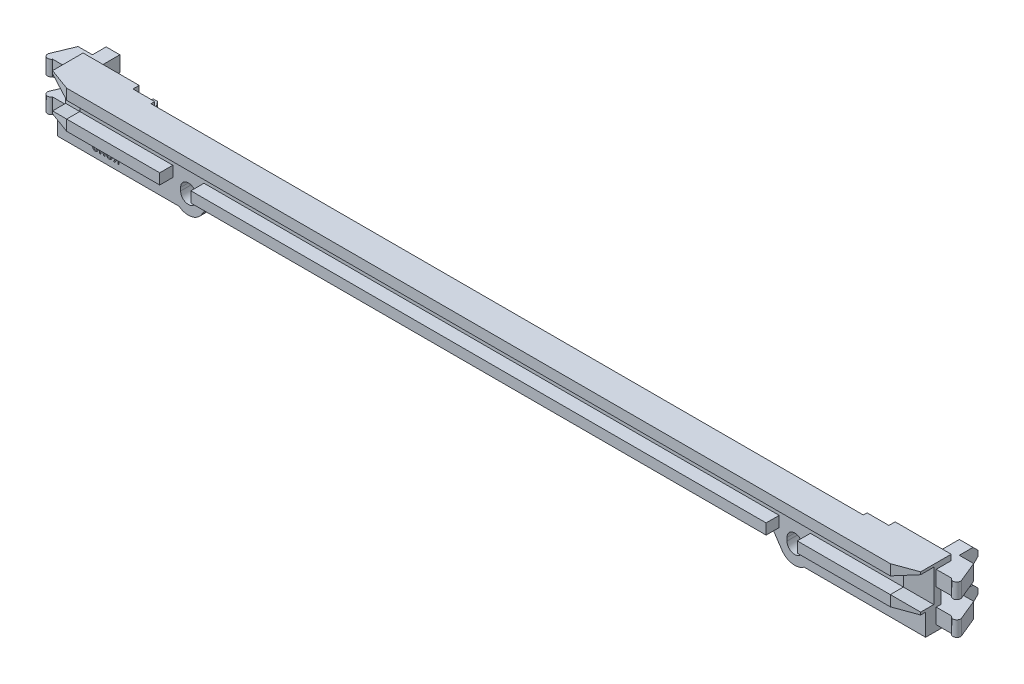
SolidWorks part; units mm, degrees
ref_plane "前视基准面" through (0, 0, 0) normal (0, 0, 1) x (1, 0, 0)
ref_plane "上视基准面" through (0, 0, 0) normal (0, 1, 0) x (1, 0, 0)
ref_plane "右视基准面" through (0, 0, 0) normal (1, 0, 0) x (0, 0, -1)
sketch "草图1" plane through (0, 0, 0) normal (0, 0, 1) x (1, 0, 0)
  line L0 (-43.0423, -1.25) -> (43.0423, -1.25)
  line L1 (-69.65, 4.75) -> (69.65, 4.75)
  line L2 (-69.65, 4.75) -> (-69.65, -4.75)
  line L3 (-69.65, -4.75) -> (-50.15, -4.75)
  line L4 (69.65, 4.75) -> (69.65, -4.75)
  line L5 (-69.65, 4.75) -> (69.65, -4.75) construction
  line L6 (-69.65, -4.75) -> (69.65, 4.75) construction
  line L7 (0, 0) -> (0, 14.6466) construction
  line L8 (-45.5403, -2.5887) -> (-46.5683, -4.1344)
  line L9 (-48.65, -1.75) -> (-48.65, -2.75) construction
  line L10 (50.15, -4.75) -> (69.65, -4.75)
  line L11 (45.5403, -2.5887) -> (46.5683, -4.1344)
  line L12 (-48.65, -2) -> (-48.65, -2.5) construction
  line L13 (-47.4, -2) -> (-47.4, -2.5)
  line L14 (-49.9, -2) -> (-49.9, -2.5)
  line L15 (48.65, -2) -> (48.65, -2.5) construction
  line L16 (47.4, -2) -> (47.4, -2.5)
  line L17 (49.9, -2) -> (49.9, -2.5)
  arc A0 (50.15, -4.75) -> (46.5683, -4.1344) centre (48.65, -2.75) cw
  arc A1 (-50.15, -4.75) -> (-46.5683, -4.1344) centre (-48.65, -2.75) ccw
  arc A2 (-47.4, -2) -> (-49.9, -2) centre (-48.65, -2) ccw
  arc A3 (-49.9, -2.5) -> (-47.4, -2.5) centre (-48.65, -2.5) ccw
  arc A4 (47.4, -2) -> (49.9, -2) centre (48.65, -2) cw
  arc A5 (49.9, -2.5) -> (47.4, -2.5) centre (48.65, -2.5) cw
  arc A6 (45.5403, -2.5887) -> (43.0423, -1.25) centre (43.0423, -4.25) ccw
  arc A7 (-45.5403, -2.5887) -> (-43.0423, -1.25) centre (-43.0423, -4.25) cw
  point P0 (0, 0)
  point P12 (-48.65, -2.25)
  point P19 (-48.65, -2.25)
  point P24 (-48.65, -0.75)
  point P25 (-48.65, -3.75)
  point P31 (48.65, -2.25)
  point P36 (44.65, -1.25)
  point P39 (-44.65, -1.25)
  dimension "D5" = 2.5
  dimension "D8" = 21
  dimension "D11" = 3
  dimension "D9" = 7.5
  dimension "D1" = 139.3
  dimension "D2" = 9.5
  dimension "D3" = 2.5
  dimension "D4" = 3
  dimension "D6" = 5.5
  dimension "D7" = 25
  dimension "D10" = 6
extrude "凸台-拉伸1" add sketch "草图1" along normal blind 2.5
sketch "草图3" plane through (0, 0, 2.5) normal (0, 0, 1) x (1, 0, 0)
  line L0 (69.65, -4.75) -> (69.65, 4.75) construction
  line L1 (-69.65, 4.75) -> (69.65, 4.75)
  line L2 (-69.65, 4.75) -> (-69.65, 3.05)
  line L3 (-69.65, 3.05) -> (69.65, 3.05)
  line L4 (69.65, 4.75) -> (69.65, 3.05)
  line L5 (-69.65, 4.75) -> (-69.65, -4.75) construction
  line L6 (-69.65, 0.45) -> (-51.15, 0.45)
  line L7 (-69.65, 0.45) -> (-69.65, -1.25)
  line L8 (-69.65, -1.25) -> (-51.15, -1.25)
  line L9 (69.65, 0.45) -> (69.65, -1.25)
  line L10 (-43.0423, -1.25) -> (43.0423, -1.25) construction
  line L11 (-51.15, 0.45) -> (-51.15, -1.25)
  line L12 (-46.15, 0.45) -> (-46.15, -1.25)
  line L13 (-46.15, 0.45) -> (46.15, 0.45)
  line L14 (-46.15, -1.25) -> (46.15, -1.25)
  line L15 (46.15, 0.45) -> (46.15, -1.25)
  line L16 (51.15, 0.45) -> (51.15, -1.25)
  line L17 (51.15, 0.45) -> (69.65, 0.45)
  line L18 (51.15, -1.25) -> (69.65, -1.25)
  dimension "D1" = 1.7
  dimension "D2" = 1.7
  dimension "D3" = 18.5
  dimension "D4" = 5
  dimension "D5" = 5
  dimension "D6" = 18.5
extrude "凸台-拉伸2" add sketch "草图3" along normal blind 2.1
sketch "草图4" plane through (0, 0, 0) normal (0, 0, -1) x (-1, 0, 0)
  line L0 (-69.65, 4.75) -> (69.65, 4.75) construction
  line L1 (-48.15, 3.25) -> (-32.9333, 3.25)
  line L2 (-48.15, 3.25) -> (-48.15, 0.15)
  line L3 (-48.15, 0.15) -> (-32.9333, 0.15)
  line L4 (-32.9333, 3.25) -> (-32.9333, 0.15)
  line L5 (-48.15, 3.25) -> (-32.9333, 0.15) construction
  line L6 (-48.15, 0.15) -> (-32.9333, 3.25) construction
  line L7 (43.0423, -1.25) -> (-43.0423, -1.25) construction
  line L8 (-31.9333, 3.25) -> (-16.7167, 3.25)
  line L9 (-31.9333, 3.25) -> (-31.9333, 0.15)
  line L10 (-31.9333, 0.15) -> (-16.7167, 0.15)
  line L11 (-16.7167, 3.25) -> (-16.7167, 0.15)
  line L12 (-31.9333, 3.25) -> (-16.7167, 0.15) construction
  line L13 (-31.9333, 0.15) -> (-16.7167, 3.25) construction
  line L14 (-15.7167, 3.25) -> (-0.5, 3.25)
  line L15 (-15.7167, 3.25) -> (-15.7167, 0.15)
  line L16 (-15.7167, 0.15) -> (-0.5, 0.15)
  line L17 (-0.5, 3.25) -> (-0.5, 0.15)
  line L18 (-15.7167, 3.25) -> (-0.5, 0.15) construction
  line L19 (-15.7167, 0.15) -> (-0.5, 3.25) construction
  line L20 (0.5, 3.25) -> (15.7167, 3.25)
  line L21 (0.5, 3.25) -> (0.5, 0.15)
  line L22 (0.5, 0.15) -> (15.7167, 0.15)
  line L23 (15.7167, 3.25) -> (15.7167, 0.15)
  line L24 (0.5, 3.25) -> (15.7167, 0.15) construction
  line L25 (0.5, 0.15) -> (15.7167, 3.25) construction
  line L26 (16.7167, 3.25) -> (31.9333, 3.25)
  line L27 (16.7167, 3.25) -> (16.7167, 0.15)
  line L28 (16.7167, 0.15) -> (31.9333, 0.15)
  line L29 (31.9333, 3.25) -> (31.9333, 0.15)
  line L30 (16.7167, 3.25) -> (31.9333, 0.15) construction
  line L31 (16.7167, 0.15) -> (31.9333, 3.25) construction
  line L32 (32.9333, 3.25) -> (48.15, 3.25)
  line L33 (32.9333, 3.25) -> (32.9333, 0.15)
  line L34 (32.9333, 0.15) -> (48.15, 0.15)
  line L35 (48.15, 3.25) -> (48.15, 0.15)
  line L36 (32.9333, 3.25) -> (48.15, 0.15) construction
  line L37 (32.9333, 0.15) -> (48.15, 3.25) construction
  line L38 (69.65, 4.75) -> (69.65, -4.75) construction
  line L39 (50.9, -3.35) -> (67.45, -3.35)
  line L40 (49.15, 0.1937) -> (49.15, 3.25)
  line L41 (49.15, 3.25) -> (67.45, 3.25)
  line L42 (67.45, -3.35) -> (67.45, 3.25)
  line L43 (0, 0) -> (0, 14.3105) construction
  line L44 (49.15, 3.25) -> (67.45, -3.35) construction
  line L45 (69.65, -4.75) -> (50.15, -4.75) construction
  line L46 (50.9, -2) -> (50.9, -3.35)
  line L47 (-50.9, -3.35) -> (-67.45, -3.35)
  line L48 (-67.45, -3.35) -> (-67.45, 3.25)
  line L49 (-49.15, 3.25) -> (-67.45, 3.25)
  line L50 (-50.9, -2) -> (-50.9, -3.35)
  line L51 (-49.15, 0.1937) -> (-49.15, 3.25)
  arc A0 (-47.4, -2) -> (-49.9, -2) centre (-48.65, -2) ccw construction
  arc A1 (49.9, -2) -> (47.4, -2) centre (48.65, -2) ccw construction
  arc A2 (50.9, -2) -> (49.15, 0.1937) centre (48.65, -2) ccw
  arc A3 (-50.9, -2) -> (-49.15, 0.1937) centre (-48.65, -2) cw
  point P0 (-40.5417, 1.7)
  point P13 (-24.325, 1.7)
  point P18 (-8.1083, 1.7)
  point P23 (8.1083, 1.7)
  point P28 (24.325, 1.7)
  point P33 (40.5417, 1.7)
  dimension "D3" = 0.5
  dimension "D5" = 0.5
  dimension "D11" = 1
  dimension "D1" = 1.5
  dimension "D2" = 1.4
  dimension "D4" = 6
  dimension "D6" = 1
  dimension "D7" = 1.5
  dimension "D8" = 2.2
  dimension "D9" = 1
  dimension "D10" = 1.4
extrude "切除-拉伸1" cut sketch "草图4" against normal blind 1.6
ref_plane "基准面1" through (0, 3.85, 0) normal (0, 1, 0) x (1, 0, 0)
sketch "草图5" plane through (0, 3.85, 0) normal (0, 1, 0) x (1, 0, 0)
  line L0 (67.35, 0) -> (69.65, 0)
  line L1 (50.15, 0) -> (69.65, 0) construction
  line L2 (69.65, 0) -> (69.65, -0.8)
  line L3 (69.65, -2.5) -> (69.65, 0) construction
  line L4 (69.65, -0.8) -> (72.1304, -0.8)
  line L5 (73.2043, -0.2704) -> (71.85, 3)
  line L6 (71.85, 3) -> (69.55, 3)
  line L7 (69.55, 3) -> (69.55, 6)
  line L8 (69.55, 6) -> (67.35, 6)
  line L9 (67.35, 6) -> (67.35, 0)
  line L11 (0, 0) -> (0, 16.9322) construction
  line L12 (-67.35, 6) -> (-67.35, 0)
  line L13 (-69.55, 6) -> (-67.35, 6)
  line L14 (-69.55, 3) -> (-69.55, 6)
  line L15 (-71.85, 3) -> (-69.55, 3)
  line L16 (-73.2043, -0.2704) -> (-71.85, 3)
  line L17 (-69.65, -0.8) -> (-72.1304, -0.8)
  line L18 (-69.65, 0) -> (-69.65, -0.8)
  line L19 (-67.35, 0) -> (-69.65, 0)
  line L23 (69.65, -4.6) -> (-69.65, -4.6) construction
  arc A0 (72.1304, -0.8) -> (73.2043, -0.2704) centre (72.65, -0.5) ccw
  arc A1 (-72.1304, -0.8) -> (-73.2043, -0.2704) centre (-72.65, -0.5) cw
  point P17 (69.65, -1.25)
  dimension "D9" = 0.6
  dimension "D1" = 10.6
  dimension "D2" = 3.8
  dimension "D3" = 0.3
  dimension "D4" = 2.3
  dimension "D5" = 2.2
  dimension "D6" = 3
  dimension "D7" = 4.5
  dimension "D8" = 3
extrude "凸台-拉伸3" add sketch "草图5" against normal blind 2.45
mirror "镜向1" about plane through (0, 0, 0) normal (0, 1, 0) of "凸台-拉伸3"
sketch "草图6" plane through (0, 0, 0) normal (0, 0, -1) x (-1, 0, 0)
  line L0 (67.45, 3.25) -> (49.15, 3.25) construction
  line L1 (69.65, 4.75) -> (57.15, 4.75)
  line L2 (69.65, 4.75) -> (69.65, 3.25)
  line L3 (69.65, 3.25) -> (57.15, 3.25)
  line L4 (57.15, 4.75) -> (57.15, 3.25)
  line L5 (50.9, -3.35) -> (67.45, -3.35) construction
  line L6 (69.65, -4.75) -> (57.15, -4.75)
  line L7 (69.65, -4.75) -> (69.65, -3.35)
  line L8 (69.65, -3.35) -> (57.15, -3.35)
  line L9 (57.15, -4.75) -> (57.15, -3.35)
  line L10 (-49.15, 3.25) -> (-67.45, 3.25) construction
  line L11 (-69.65, 4.75) -> (-57.15, 4.75)
  line L12 (-69.65, 4.75) -> (-69.65, 3.25)
  line L13 (-69.65, 3.25) -> (-57.15, 3.25)
  line L14 (-57.15, 4.75) -> (-57.15, 3.25)
  line L15 (-67.35, -3.35) -> (-50.9, -3.35) construction
  line L16 (-69.65, -4.75) -> (-57.15, -4.75)
  line L17 (-69.65, -4.75) -> (-69.65, -3.35)
  line L18 (-69.65, -3.35) -> (-57.15, -3.35)
  line L19 (-57.15, -4.75) -> (-57.15, -3.35)
  dimension "D1" = 12.5
  dimension "D2" = 12.5
  dimension "D3" = 12.5
  dimension "D4" = 12.5
extrude "凸台-拉伸4" add sketch "草图6" along normal blind 0.6
sketch "草图7" plane through (0, 0, -0.6) normal (0, 0, -1) x (-1, 0, 0)
  line L0 (-49.15, 3.25) -> (-67.45, 3.25) construction
  line L1 (-69.65, 4.75) -> (-60.65, 4.75)
  line L2 (-69.65, 4.75) -> (-69.65, 3.25)
  line L3 (-69.65, 3.25) -> (-60.65, 3.25)
  line L4 (-60.65, 4.75) -> (-60.65, 3.25)
  line L5 (-57.15, -3.35) -> (-67.35, -3.35) construction
  line L6 (-69.65, -4.75) -> (-60.65, -4.75)
  line L7 (-69.65, -4.75) -> (-69.65, -3.35)
  line L8 (-69.65, -3.35) -> (-60.65, -3.35)
  line L9 (-60.65, -4.75) -> (-60.65, -3.35)
  line L10 (67.45, 3.25) -> (49.15, 3.25) construction
  line L11 (69.65, 4.75) -> (60.65, 4.75)
  line L12 (69.65, 4.75) -> (69.65, 3.25)
  line L13 (69.65, 3.25) -> (60.65, 3.25)
  line L14 (60.65, 4.75) -> (60.65, 3.25)
  line L15 (50.9, -3.35) -> (67.45, -3.35) construction
  line L16 (69.65, -4.75) -> (60.65, -4.75)
  line L17 (69.65, -4.75) -> (69.65, -3.35)
  line L18 (69.65, -3.35) -> (60.65, -3.35)
  line L19 (60.65, -4.75) -> (60.65, -3.35)
  dimension "D1" = 9
extrude "凸台-拉伸5" add sketch "草图7" along normal blind 1
chamfer "倒角1" distance 1.3 angle 70 10 edges at (69.65, 3.9, 4.6) (69.65, -0.4, 4.6) (69.65, 0.45, 3.55) (-69.65, -0.4, 4.6) (-69.65, 0.45, 3.55) (-69.65, 3.9, 4.6)
chamfer "倒角2" distance 0.8 angle 45 12 edges at (68.45, -3.85, -6) (67.35, -2.625, -6) (68.45, -1.4, -6) (68.45, 1.4, -6) (67.35, 2.625, -6) (68.45, 3.85, -6) (-68.45, -3.85, -6) (-67.35, -2.625, -6) (-68.45, -1.4, -6) (-68.45, 1.4, -6) (-67.35, 2.625, -6) (-68.45, 3.85, -6)
sketch "草图9" plane through (0, 0, 0) normal (0, 1, 0) x (1, 0, 0)
  line L0 (-60.9, 4.1) -> (-60.9, -1.6)
  line L1 (-50.9, -1.6) -> (-67.45, -1.6) construction
  line L2 (-60.9, -1.6) -> (-58.9, -1.6)
  line L3 (-58.9, -1.6) -> (-59.5897, 3.3078)
  line L4 (-60.2, 4.1) -> (-60.9, 4.1)
  line L5 (-60.2, 4.1) -> (-59.5897, 3.3078)
  line L6 (66.0783, -4.6) -> (-66.0783, -4.6) construction
  line L7 (-69.65, -3.3) -> (-69.65, 1.6) construction
  line L8 (0, 0) -> (0, 15.3008) construction
  line L9 (60.2, 4.1) -> (59.5897, 3.3078)
  line L10 (60.2, 4.1) -> (60.9, 4.1)
  line L11 (58.9, -1.6) -> (59.5897, 3.3078)
  line L12 (60.9, -1.6) -> (58.9, -1.6)
  line L13 (60.9, 4.1) -> (60.9, -1.6)
  dimension "D1" = 8.7
  dimension "D2" = 8.75
  dimension "D3" = 2
  dimension "D4" = 0.7
  dimension "D5" = 8
  dimension "D6" = 1
extrude "凸台-拉伸6" add sketch "草图9" along normal mid plane 3
sketch "草图10" plane through (0, 0, 2.5) normal (0, 0, 1) x (1, 0, 0)
  line L0 (-53.0759, -2.25) -> (-64.15, -2.25) construction
  line L2 (-69.65, -1.25) -> (-51.15, -1.25) construction
  line L3 (-69.65, -1.25) -> (-69.65, -4.75) construction
  text T0 "KONO" font "黑体" height 1.5
  dimension "D1" = 1
  dimension "D2" = 5.5
extrude "切除-拉伸2" cut sketch "草图10" against normal blind 0.2
